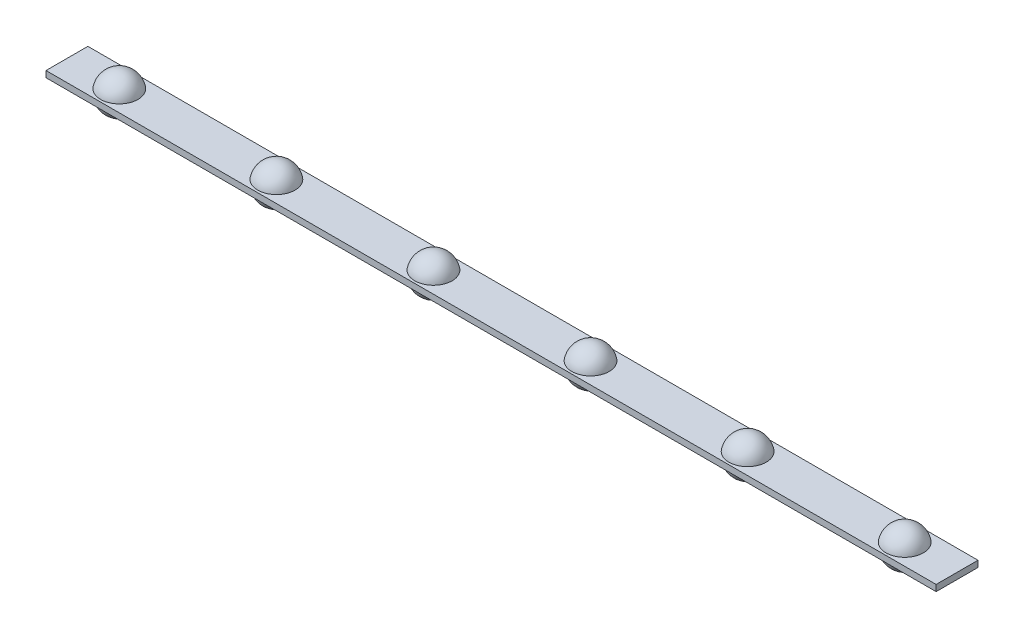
SolidWorks part; units mm, degrees
ref_plane "Front Plane" through (0, 0, 0) normal (0, 0, 1) x (1, 0, 0)
ref_plane "Top Plane" through (0, 0, 0) normal (0, 1, 0) x (1, 0, 0)
ref_plane "Right Plane" through (0, 0, 0) normal (1, 0, 0) x (0, 0, -1)
imported_body "Imported3"
sketch "Sketch1" plane through (-465.963, 0, 0) normal (-1, 0, 0) x (0, 0, 1)
  line L0 (0.5017, 13.3641) -> (0.5017, 14.1261)
  line L1 (0.5017, 14.1261) -> (2.7686, 14.1261)
  line L2 (2.7686, 14.1261) -> (5.0355, 14.1261)
  line L3 (5.0355, 14.1261) -> (5.0355, 13.3641)
  line L4 (5.0355, 13.3641) -> (2.7686, 13.3641)
  line L5 (2.7686, 13.3641) -> (0.5017, 13.3641)
  line L6 (0.5017, 13.3641) -> (5.0355, 13.3641) construction
  dimension "D1" = 2.2669
  dimension "D2" = 4.5338
  dimension "D3" = 0.762
extrude "Boss-Extrude1" add sketch "Sketch1" along normal blind 2.2669
sketch "Sketch2" plane through (-370.713, 0, 0) normal (1, 0, 0) x (0, 0, -1)
  line L0 (-0.5017, 13.3641) -> (-2.7686, 13.3641)
  line L1 (-2.7686, 13.3641) -> (-5.0355, 13.3641)
  line L2 (-5.0355, 13.3641) -> (-5.0355, 14.1261)
  line L3 (-5.0355, 14.1261) -> (-2.7686, 14.1261)
  line L4 (-2.7686, 14.1261) -> (-0.5017, 14.1261)
  line L5 (-0.5017, 14.1261) -> (-0.5017, 13.3641)
  line L6 (-0.5017, 14.1261) -> (-0.5017, 13.3641) construction
  line L7 (-0.5017, 13.3641) -> (-5.0355, 13.3641) construction
  dimension "D1" = 2.2669
  dimension "D2" = 4.5338
  dimension "D3" = 0.762
extrude "Boss-Extrude2" add sketch "Sketch2" along normal blind 2.2669
sketch "Sketch3" plane through (0, 0, 0.5017) normal (0, 0, -1) x (-1, 0, 0)
  line L0 (468.2299, 14.1261) -> (468.2299, 13.3641)
  line L1 (468.2299, 13.3641) -> (368.4461, 13.3641)
  line L2 (368.4461, 13.3641) -> (368.4461, 14.1261)
  line L3 (368.4461, 14.1261) -> (468.2299, 14.1261)
  line L4 (468.2299, 14.1261) -> (468.2299, 13.3641) construction
  line L5 (468.2299, 13.3641) -> (465.963, 13.3641) construction
  dimension "D1" = 99.7838
  dimension "D2" = 0.762
extrude "Boss-Extrude3" add sketch "Sketch3" along normal blind 0.2731
sketch "Sketch4" plane through (-468.2299, 0, 0) normal (-1, 0, 0) x (0, 0, 1)
  line L0 (5.0355, 14.1261) -> (5.0355, 13.3641)
  line L1 (5.0355, 13.3641) -> (0.2286, 13.3641)
  line L2 (0.2286, 13.3641) -> (0.2286, 14.1261)
  line L3 (0.2286, 14.1261) -> (5.0355, 14.1261)
  line L4 (0.2286, 13.3641) -> (2.7686, 13.3641) construction
  dimension "D1" = 4.8069
  dimension "D2" = 0.762
extrude "Boss-Extrude4" add sketch "Sketch4" along normal blind 4.0831
sketch "Sketch5" plane through (-368.4461, 0, 0) normal (1, 0, 0) x (0, 0, -1)
  line L0 (-5.0355, 14.1261) -> (-0.2286, 14.1261)
  line L1 (-0.2286, 14.1261) -> (-0.2286, 13.3641)
  line L2 (-0.2286, 13.3641) -> (-5.0355, 13.3641)
  line L3 (-5.0355, 13.3641) -> (-5.0355, 14.1261)
  line L4 (-2.7686, 13.3641) -> (-0.2286, 13.3641) construction
  dimension "D1" = 2.54
  dimension "D2" = 2.2669
  dimension "D3" = 0.762
extrude "Boss-Extrude5" add sketch "Sketch5" along normal blind 4.0831
sketch "Sketch6" plane through (0, 0, 5.0355) normal (0, 0, 1) x (1, 0, 0)
  line L0 (-364.363, 14.1261) -> (-364.363, 13.3641)
  line L1 (-364.363, 13.3641) -> (-472.313, 13.3641)
  line L2 (-472.313, 13.3641) -> (-472.313, 14.1261)
  line L3 (-472.313, 14.1261) -> (-364.363, 14.1261)
  line L4 (-472.313, 13.3641) -> (-472.313, 14.1261) construction
  line L5 (-472.313, 13.3641) -> (-465.963, 13.3641) construction
  dimension "D1" = 107.95
  dimension "D2" = 0.762
extrude "Boss-Extrude6" add sketch "Sketch6" along normal blind 0.2731
